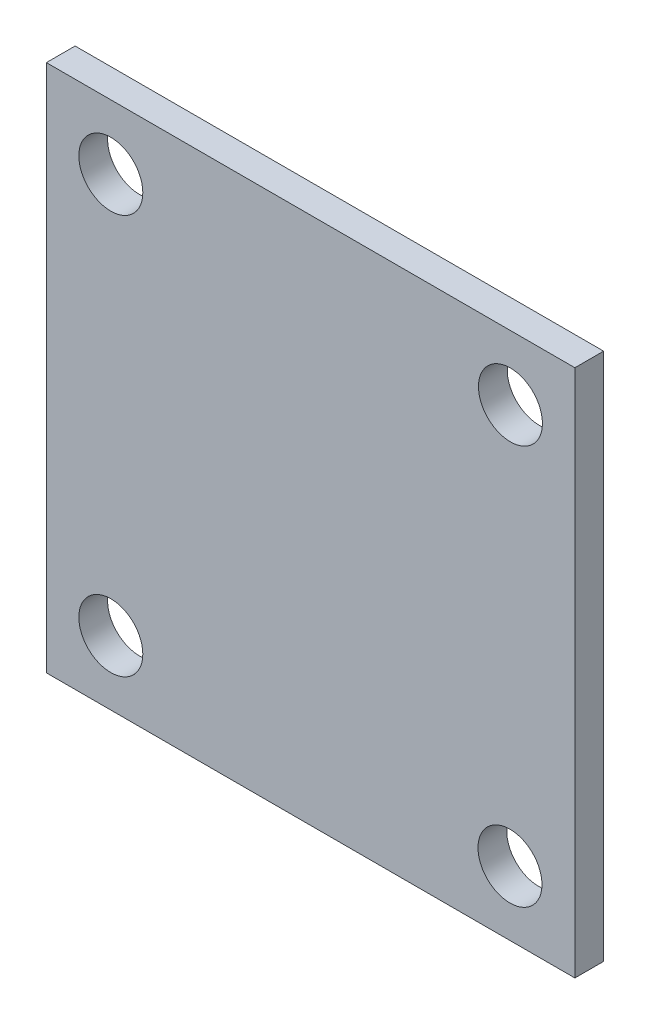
SolidWorks part; units mm, degrees
ref_plane "Front Plane" through (0, 0, 0) normal (0, 0, 1) x (1, 0, 0)
ref_plane "Top Plane" through (0, 0, 0) normal (0, 1, 0) x (1, 0, 0)
ref_plane "Right Plane" through (0, 0, 0) normal (1, 0, 0) x (0, 0, -1)
imported_body "Imported1"
sketch "Sketch1" plane through (0, 0, 1.5748) normal (0, 0, 1) x (1, 0, 0)
  circle A0 centre (61.0627, 149.0832) radius 9.992
extrude "Boss-Extrude1" add sketch "Sketch1" against normal up to surface (1.5748 mm away)
